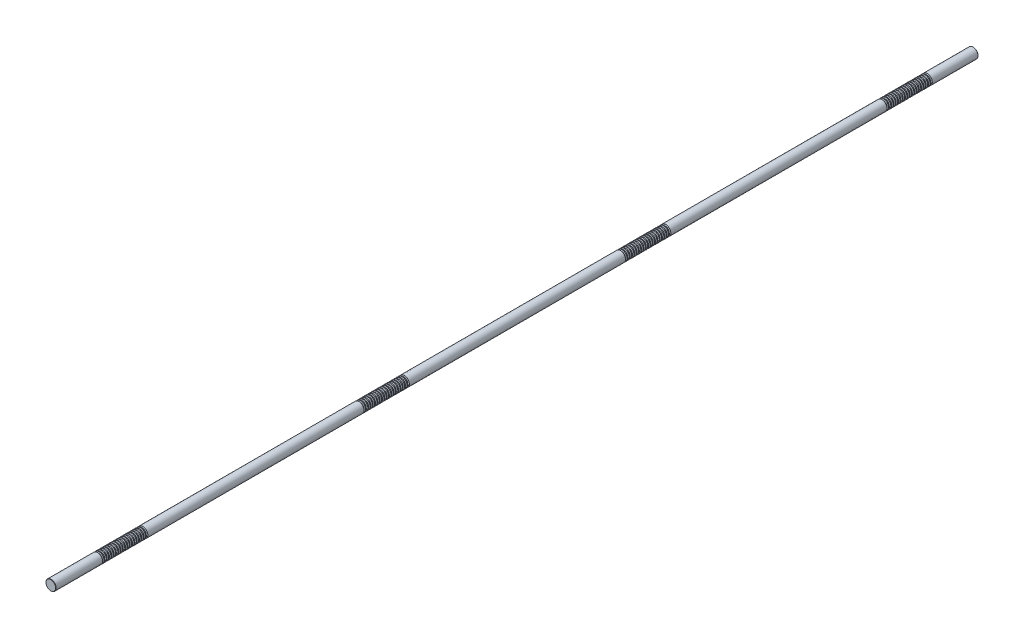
SolidWorks part; units mm, degrees
ref_plane "Front Plane" through (0, 0, 0) normal (0, 0, 1) x (1, 0, 0)
ref_plane "Top Plane" through (0, 0, 0) normal (0, 1, 0) x (1, 0, 0)
ref_plane "Right Plane" through (0, 0, 0) normal (1, 0, 0) x (0, 0, -1)
sketch "Sketch1" plane through (0, 0, 0) normal (0, 0, 1) x (1, 0, 0)
  circle A0 centre (0, 0) radius 11
  dimension "D1" = 22
extrude "Boss-Extrude1" add sketch "Sketch1" along normal mid plane 2000
chamfer "Chamfer1" distance 0.55 angle 45 2 edges at (11, 0, -1000) (11, 0, 1000)
sketch "Sketch2" plane through (0, 0, 0) normal (1, 0, 0) x (0, 0, -1)
  line L0 (900.3684, 11) -> (897.1316, 11)
  line L1 (999.45, 11) -> (-999.45, 11) construction
  line L2 (897.1316, 11) -> (897.8684, 8.25)
  line L3 (897.8684, 8.25) -> (899.6316, 8.25)
  line L4 (899.6316, 8.25) -> (900.3684, 11)
  line L5 (1000, -10.45) -> (1000, 10.45) construction
  point P4 (898.75, 11)
  point P7 (898.75, 8.25)
  point P8 (900, 9.625)
  point P9 (897.5, 9.625)
  dimension "D1" = 2.5
  dimension "D2" = 100
  dimension "D3" = 2.75
  dimension "D4" = 30
revolve "Cut-Revolve1" cut sketch "Sketch2" angle 360 about axis through (0, 0, 1000) along (0, 0, -1)
pattern_linear "LPattern1" count 20 spacing 5 along (0, 0, 1) of "Cut-Revolve1"
pattern_linear "LPattern2" count 4 spacing 567 along (0, 0, 1) of "Cut-Revolve1", "LPattern1"
